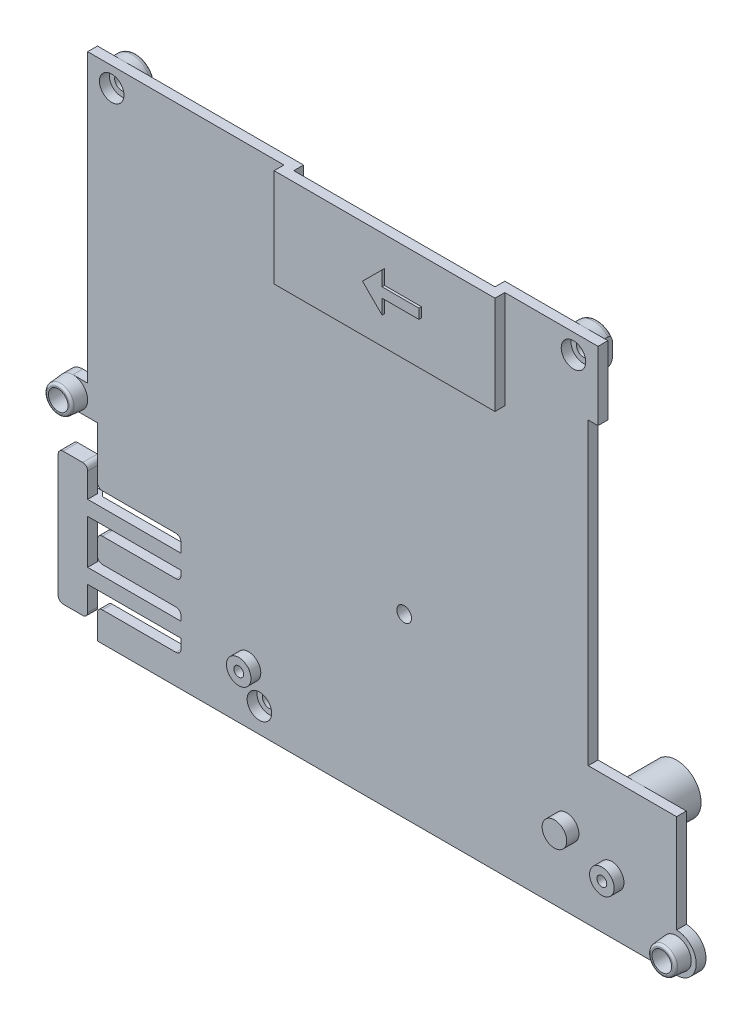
SolidWorks part; units mm, degrees
ref_plane "Face" through (0, 0, 0) normal (0, 0, 1) x (1, 0, 0)
ref_plane "Dessus" through (0, 0, 0) normal (0, 1, 0) x (1, 0, 0)
ref_plane "Droite" through (0, 0, 0) normal (1, 0, 0) x (0, 0, -1)
sketch "Esquisse1" plane through (0, 0, 0) normal (0, 0, 1) x (1, 0, 0)
  line L0 (0, -64.5) -> (2, -64.5)
  line L1 (0, 0) -> (0, -58.5)
  line L2 (2, -103) -> (120, -103)
  line L3 (120, -95) -> (120, -75)
  line L4 (120, -75) -> (102, -75)
  line L5 (102, -75) -> (102, -14)
  line L6 (102, -14) -> (104, -14)
  line L7 (104, -14) -> (104, 0)
  line L8 (104, 0) -> (0, 0)
  line L9 (2, -64.5) -> (2, -103)
  line L10 (0, -64.5) -> (-3, -64.5)
  line L11 (-3, -58.5) -> (0, -58.5)
  arc A0 (-3, -58.5) -> (-3, -64.5) centre (-3, -61.5) ccw
  arc A1 (120, -103) -> (120, -95) centre (120, -99) ccw
  dimension "D10" = 6
  dimension "D11" = 8
  dimension "D1" = 120
  dimension "D2" = 104
  dimension "D3" = 103
  dimension "D4" = 14
  dimension "D5" = 28
  dimension "D6" = 2
  dimension "D7" = 38.5
  dimension "D8" = 2
  dimension "D9" = 3
extrude "Extrusion1" add sketch "Esquisse1" along normal blind 2
sketch "Esquisse2" plane through (0, 0, 2) normal (0, 0, 1) x (1, 0, 0)
  line L0 (40, 0) -> (40, -20)
  line L1 (40, -20) -> (85, -20)
  line L2 (85, -20) -> (85, 0)
  line L3 (85, 0) -> (40, 0)
  line L4 (104, -14) -> (104, 0) construction
  line L5 (104, 0) -> (0, 0) construction
  dimension "D1" = 45
  dimension "D2" = 20
  dimension "D3" = 19
extrude "Extrusion2" add sketch "Esquisse2" along normal blind 2
sketch "Esquisse3" plane through (0, 0, 0) normal (0, 0, -1) x (-1, 0, 0)
  line L0 (-83, 0) -> (-83, -18)
  line L1 (-83, -18) -> (-42, -18)
  line L2 (-42, -18) -> (-42, 0)
  line L3 (-42, 0) -> (-83, 0)
  line L4 (-104, 0) -> (0, 0) construction
  line L5 (-40, -20) -> (-85, -20) construction
  line L6 (-40, 0) -> (-40, -20) construction
  line L7 (-85, -20) -> (-85, 0) construction
  dimension "D1" = 2
  dimension "D2" = 2
  dimension "D3" = 2
extrude "Enlèv. mat.-Extru.4" cut sketch "Esquisse3" against normal blind 2
sketch "Esquisse4" plane through (0, 0, 0) normal (0, 0, -1) x (-1, 0, 0)
  line L0 (-2, -103) -> (-120, -103) construction
  line L4 (-10, -68) -> (-12, -68)
  line L5 (-10, -50) -> (-10, -68)
  line L6 (-12, -68) -> (-12, -50)
  line L7 (-32, -19.6026) -> (-32, -21.7157)
  line L8 (0, 0) -> (0, -58.5) construction
  arc A2 (-10, -50) -> (-32, -19.6026) centre (-42, -50) ccw
  arc A3 (-12, -50) -> (-32, -21.7157) centre (-42, -50) ccw
  dimension "D1" = 30
  dimension "D2" = 32
  dimension "D3" = 42
  dimension "D4" = 53
  dimension "D5" = 18
  dimension "D6" = 10
extrude "Extrusion3" add sketch "Esquisse4" along normal blind 9.5
sketch "Esquisse5" plane through (0, 0, 0) normal (0, 0, -1) x (-1, 0, 0)
  line L6 (-85, -12.7047) -> (-85, -20)
  line L7 (-85, -12.7047) -> (-83, -13.02)
  line L8 (-83, -18) -> (-83, -13.02)
  line L9 (-42, -18) -> (-83, -18)
  line L10 (-85, -20) -> (-42, -20)
  line L11 (-32, -19.6026) -> (-32, -21.7157)
  line L12 (-32, -19.6026) -> (-32, -21.7157) construction
  line L13 (-83, 0) -> (-83, -18) construction
  line L14 (-85, -20) -> (-85, 0) construction
  arc A2 (-32, -19.6026) -> (-42, -18) centre (-42, -50) ccw
  arc A3 (-32, -21.7157) -> (-42, -20) centre (-42, -50) ccw
  arc A4 (-10, -50) -> (-32, -19.6026) centre (-42, -50) ccw construction
  arc A5 (-12, -50) -> (-32, -21.7157) centre (-42, -50) ccw construction
  dimension "D1" = 4.98
  dimension "D2" = 7.2953
extrude "Extrusion4" add sketch "Esquisse5" along normal blind 7
sketch "Esquisse6" plane through (0, 0, 2) normal (0, 0, 1) x (1, 0, 0)
  line L0 (-5.2627, -4) -> (14.8101, -4) construction
  line L1 (5, -14.2007) -> (5, 2.4267) construction
  line L2 (99, -4) -> (110.53, -4) construction
  line L3 (99, -4) -> (99, -14.1813) construction
  line L4 (89, -38) -> (73, -38) construction
  line L5 (73, -26) -> (78, -26) construction
  line L6 (87, -47) -> (92.5544, -47) construction
  line L7 (92.5544, -47) -> (87, -47) construction
  line L8 (87, -47) -> (87, -52.8482) construction
  line L9 (64.5, -67) -> (51.66, -67) construction
  line L10 (64.5, -67) -> (64.5, -58.9898) construction
  line L11 (35, -98) -> (45.5183, -98) construction
  line L12 (35, -98) -> (35, -106.1757) construction
  line L13 (32.78, -92) -> (106.78, -92) construction
  line L14 (71.55, -91) -> (87.55, -91) construction
  line L15 (51.61, -85) -> (51.61, -89.5483) construction
  line L16 (51.61, -89.5483) -> (51.61, -85) construction
  line L17 (51.61, -85) -> (59.749, -85) construction
  line L18 (97.61, -88) -> (97.61, -82.5079) construction
  line L19 (97.61, -82.5079) -> (97.61, -88) construction
  line L20 (97.61, -88) -> (102.441, -88) construction
  line L21 (110, -80) -> (110, -86.8519) construction
  line L22 (110, -80) -> (124.3112, -80) construction
  line L23 (120, -99) -> (106.78, -99) construction
  line L24 (120, -99) -> (120, -106.1757) construction
  line L25 (40, 0) -> (0, 0) construction
  line L26 (0, 0) -> (0, -58.5) construction
  line L27 (104, -14) -> (104, 0) construction
  line L28 (2, -103) -> (120, -103) construction
  line L29 (120, -95) -> (120, -75) construction
  line L30 (120, -75) -> (102, -75) construction
  line L31 (120, -95) -> (120, -75) construction
  line L32 (102, -75) -> (102, -14) construction
  point P27 (120, -85)
  dimension "D1" = 4
  dimension "D2" = 5
  dimension "D3" = 5
  dimension "D4" = 4
  dimension "D5" = 85
  dimension "D6" = 5
  dimension "D7" = 11
  dimension "D8" = 7
  dimension "D9" = 16.61
  dimension "D10" = 46
  dimension "D11" = 10
  dimension "D12" = 5
  dimension "D13" = 3
  dimension "D14" = 12
  dimension "D15" = 36
  dimension "D16" = 37.5
  dimension "D17" = 15
  dimension "D18" = 20
  dimension "D19" = 9
  dimension "D20" = 12
sketch "Esquisse7" plane through (0, 0, 4) normal (0, 0, 1) x (1, 0, 0)
  line L7 (62.5, -14) -> (58.5, -10)
  line L8 (58.5, -10) -> (62.5, -6)
  line L9 (62.5, -6) -> (62.5, -9)
  line L10 (62.5, -9) -> (70, -9)
  line L11 (70, -9) -> (70, -11)
  line L12 (70, -11) -> (62.5, -11)
  line L13 (62.5, -11) -> (62.5, -14)
  line L14 (85, -20) -> (85, 0) construction
  line L15 (85, 0) -> (40, 0) construction
  dimension "D1" = 7.5
  dimension "D2" = 2
  dimension "D3" = 90
  dimension "D4" = 3
  dimension "D5" = 3
  dimension "D6" = 15
  dimension "D7" = 9
  dimension "D8" = 1
extrude "Extrusion5" add sketch "Esquisse7" along normal blind 0.5
sketch "Esquisse8" plane through (0, 0, 0) normal (0, 0, -1) x (-1, 0, 0)
  line L0 (-2, -103) -> (-120, -103) construction
  line L1 (-75, -45) -> (-48, -45)
  line L2 (-75, -45) -> (-75, -47)
  line L3 (-75, -47) -> (-48, -47)
  line L4 (-48, -45) -> (-48, -47)
  line L5 (-102, -75) -> (-102, -14) construction
  dimension "D1" = 27
  dimension "D2" = 2
  dimension "D3" = 56
  dimension "D4" = 27
extrude "Extrusion6" add sketch "Esquisse8" along normal blind 7.5
sketch "Esquisse9" plane through (0, 0, 0) normal (0, 0, -1) x (-1, 0, 0)
  line L0 (0, 0) -> (0, -58.5) construction
  line L1 (-48, -66) -> (-17, -66)
  line L2 (-48, -66) -> (-48, -68)
  line L3 (-48, -68) -> (-17, -68)
  line L4 (-17, -66) -> (-17, -68)
  line L5 (-48, -71) -> (-17, -71)
  line L6 (-48, -71) -> (-48, -73)
  line L7 (-48, -73) -> (-17, -73)
  line L8 (-17, -71) -> (-17, -73)
  line L9 (-2, -103) -> (-120, -103) construction
  dimension "D1" = 17
  dimension "D2" = 31
  dimension "D3" = 2
  dimension "D4" = 2
  dimension "D5" = 3
  dimension "D6" = 30
extrude "Extrusion7" add sketch "Esquisse9" along normal blind 4
sketch "Esquisse10" plane through (0, 0, 0) normal (0, 0, -1) x (-1, 0, 0)
  line L1 (-48, -71) -> (-46, -71)
  line L2 (-48, -71) -> (-48, -98)
  line L3 (-48, -98) -> (-46, -98)
  line L4 (-46, -71) -> (-46, -98)
  dimension "D1" = 2
  dimension "D2" = 27
extrude "Extrusion8" add sketch "Esquisse10" along normal blind 6 draft 5
sketch "Esquisse11" plane through (0, 0, 0) normal (0, 0, -1) x (-1, 0, 0)
  line L0 (5.2627, -4) -> (-14.8101, -4) construction
  line L1 (-5, -14.2007) -> (-5, 2.4267) construction
  circle A0 centre (-5, -4) radius 4
  circle A1 centre (-99, -4) radius 4
  circle A2 centre (-35, -98) radius 4
  dimension "D1" = 8
  dimension "D2" = 8
  dimension "D3" = 8
extrude "Extrusion9" add sketch "Esquisse11" along normal blind 3
fillet "Congé1" radius 1 3 edges at (1, -4, -3) (31, -98, -3) (95, -4, -3)
sketch "Esquisse12" plane through (0, 0, 0) normal (0, 0, -1) x (-1, 0, 0)
  circle A0 centre (-64.5, -67) radius 4
  dimension "D1" = 8
extrude "Extrusion10" add sketch "Esquisse12" along normal blind 7
sketch "Esquisse13" plane through (0, 0, 0) normal (0, 0, -1) x (-1, 0, 0)
  circle A0 centre (-110, -80) radius 5
  dimension "D1" = 10
extrude "Extrusion11" add sketch "Esquisse13" along normal blind 8
sketch "Esquisse14" plane through (0, 0, -8) normal (0, 0, -1) x (-1, 0, 0)
  circle A0 centre (-110, -80) radius 3
  circle A1 centre (-110, -80) radius 5 construction
  dimension "D1" = 6
extrude "Enlèv. mat.-Extru.5" cut sketch "Esquisse14" against normal blind 5
sketch "Esquisse15" plane through (0, 0, 0) normal (0, 0, -1) x (-1, 0, 0)
  circle A0 centre (-97.61, -88) radius 3
  dimension "D1" = 6
extrude "Extrusion12" add sketch "Esquisse15" along normal blind 6.3
sketch "Esquisse17" plane through (0, 0, 0) normal (0, 0, -1) x (-1, 0, 0)
  line L0 (-42, 0) -> (-5, 0) construction
  line L1 (-104, 0) -> (-102, 0)
  line L2 (-104, 0) -> (-104, -8)
  line L3 (-104, -8) -> (-102, -8)
  line L4 (-102, 0) -> (-102, -8)
  line L5 (-104, -14) -> (-104, 0) construction
  line L6 (0, 0) -> (0, -58.5) construction
  line L8 (-2, 0) -> (0, 0)
  line L9 (-2, 0) -> (-2, -8)
  line L10 (-2, -8) -> (0, -8)
  line L11 (0, 0) -> (0, -8)
  line L12 (-2, -103) -> (-120, -103) construction
  line L13 (-39, -103) -> (-31, -103)
  line L14 (-39, -103) -> (-39, -101)
  line L15 (-39, -101) -> (-31, -101)
  line L16 (-31, -103) -> (-31, -101)
  circle A2 centre (-99, -4) radius 4 construction
  circle A3 centre (-5, -4) radius 4 construction
  circle A4 centre (-35, -98) radius 4 construction
  dimension "D1" = 2
  dimension "D2" = 2
  dimension "D3" = 2
extrude "Enlèv. mat.-Extru.7" cut sketch "Esquisse17" along normal up to next
sketch "Esquisse18" plane through (0, 0, 2) normal (0, 0, 1) x (1, 0, 0)
  circle A0 centre (120, -99) radius 3
  circle A1 centre (-3, -61.5) radius 3
  arc A2 (-3, -58.5) -> (-3, -64.5) centre (-3, -61.5) ccw construction
  dimension "D1" = 6
  dimension "D2" = 6
extrude "Extrusion13" add sketch "Esquisse18" along normal blind 3 draft 5
sketch "Esquisse19" plane through (0, 0, 5) normal (0, 0, 1) x (1, 0, 0)
  circle A0 centre (-3, -61.5) radius 2
  circle A1 centre (120, -99) radius 2
  circle A4 centre (-3, -61.5) radius 2.7375 construction
  dimension "D1" = 4
  dimension "D2" = 4
extrude "Enlèv. mat.-Extru.8" cut sketch "Esquisse19" against normal blind 3
fillet "Congé2" radius 0.5 2 edges at (122.7375, -99, 5) (-0.2625, -61.5, 5)
sketch "Esquisse20" plane through (0, 0, 2) normal (0, 0, 1) x (1, 0, 0)
  circle A0 centre (97.61, -88) radius 2.5
  dimension "D1" = 5
extrude "Extrusion14" add sketch "Esquisse20" along normal blind 2.5
sketch "Esquisse21" plane through (0, 0, 2) normal (0, 0, 1) x (1, 0, 0)
  circle A0 centre (32.78, -92) radius 2.5
  circle A1 centre (106.78, -92) radius 2.5
  dimension "D1" = 5
  dimension "D2" = 5
extrude "Extrusion15" add sketch "Esquisse21" along normal blind 2
sketch "Esquisse16" plane through (0, 0, 0) normal (0, 0, -1) x (-1, 0, 0)
  circle A0 centre (-106.78, -92) radius 1
  circle A1 centre (-32.78, -92) radius 1
  dimension "D1" = 2
  dimension "D2" = 2
extrude "Enlèv. mat.-Extru.6" cut sketch "Esquisse16" against normal through all
hole_wizard "Chambrage pour vis à tête hexagonale M2.51" positions "Esquisse3D1" profile "Esquisse22" counterbore size "M2.5" standard "ISO"
sketch3d "Esquisse3D1"
  line L0 (-5.2627, -4, 2) -> (14.8101, -4, 2) construction
  point P0 (4.9018, -4, 2)
  point P3 (35, -98, 2)
  point P5 (99, -4, 2)
sketch "Esquisse22" plane through (4.9018, -4, 2) normal (1, 0, 0) x (0, -1, 0)
  line L0 (0, 0) -> (0, 29.8412)
  line L1 (0, 29.8412) -> (1.4, 29)
  line L2 (1.4, 29) -> (1.4, 2)
  line L3 (1.4, 2) -> (2.5, 2)
  line L4 (2.5, 2) -> (2.5, 0)
  line L5 (2.5, 0) -> (0, 0)
  line L10 (0, 29.8412) -> (-1.4, 29) construction
  line L11 (0, -6.35) -> (0, 107.95) construction
  dimension "Diamètre du perçage" = 2.8
  dimension "Profondeur du perçage" = 29
  dimension "Diamètre du chambrage" = 5
  dimension "Profondeur du chambrage" = 2
  dimension "Angle de pointe" = 118
hole_wizard "Dégagement M2.51" positions "Esquisse24" profile "Esquisse23" hole size "M2.5" standard "Ansi Métrique"
sketch "Esquisse24" plane through (0, 0, 2) normal (0, 0, 1) x (1, 0, 0)
  circle A0 centre (-3, -61.5) radius 2.2794 construction
  circle A1 centre (120, -99) radius 2 construction
  point P0 (-3, -61.5)
  point P3 (120, -99)
sketch "Esquisse23" plane through (-3, -61.5, 2) normal (1, 0, 0) x (0, -1, 0)
  line L0 (0, 0) -> (0, 11.5)
  line L1 (0, 11.5) -> (1.4, 11.5)
  line L2 (1.4, 11.5) -> (1.4, 0)
  line L5 (1.4, 0) -> (0, 0)
  line L11 (0, -6.35) -> (0, 107.95) construction
  dimension "Diamètre du perçage jusqu'au prochain" = 2.8
  dimension "Profondeur du perçage jusqu'au prochain" = 11.5
sketch "Esquisse25" plane through (0, 0, 2) normal (0, 0, 1) x (1, 0, 0)
  line L0 (2, -103) -> (120, -103) construction
  line L1 (2, -76) -> (18, -76)
  line L2 (2, -76) -> (2, -79)
  line L3 (2, -79) -> (19, -79)
  line L4 (19, -77) -> (19, -79)
  line L5 (2, -82) -> (19, -82)
  line L6 (2, -82) -> (2, -84)
  line L7 (2, -84) -> (18, -84)
  line L8 (19, -82) -> (19, -83)
  line L9 (2, -89) -> (18, -89)
  line L10 (2, -89) -> (2, -91)
  line L11 (2, -91) -> (19, -91)
  line L12 (19, -90) -> (19, -91)
  line L13 (2, -94) -> (19, -94)
  line L14 (2, -94) -> (2, -97)
  line L15 (2, -97) -> (18, -97)
  line L16 (19, -94) -> (19, -96)
  line L17 (2, -64.5) -> (2, -103) construction
  arc A0 (18, -76) -> (19, -77) centre (18, -77) cw
  arc A1 (18, -84) -> (19, -83) centre (18, -83) ccw
  arc A2 (18, -89) -> (19, -90) centre (18, -90) cw
  arc A3 (18, -97) -> (19, -96) centre (18, -96) ccw
  point P30 (19, -97)
  dimension "D10" = 1
  dimension "D1" = 6
  dimension "D2" = 3
  dimension "D3" = 3
  dimension "D4" = 2
  dimension "D5" = 5
  dimension "D6" = 2
  dimension "D7" = 3
  dimension "D8" = 3
  dimension "D9" = 17
extrude "Enlèv. mat.-Extru.9" cut sketch "Esquisse25" against normal through all
fillet "Congé3" radius 1 4 edges at (2, -76, 1) (2, -97, 1) (2, -89, 1) (2, -84, 1)
sketch "Esquisse26" plane through (0, 0, 2) normal (0, 0, 1) x (1, 0, 0)
  line L0 (2, -79) -> (0, -79)
  line L1 (0, -79) -> (0, -73)
  line L2 (0, -73) -> (-6, -73)
  line L3 (-6, -73) -> (-6, -100)
  line L4 (-6, -100) -> (0, -100)
  line L5 (0, -100) -> (0, -94)
  line L6 (0, -94) -> (2, -94)
  line L7 (2, -94) -> (2, -91)
  line L8 (2, -91) -> (0, -91)
  line L9 (0, -91) -> (0, -82)
  line L10 (0, -82) -> (2, -82)
  line L11 (2, -82) -> (2, -79)
  line L12 (2, -91) -> (2, -94) construction
  line L13 (2, -91) -> (19, -91) construction
  line L14 (19, -82) -> (2, -82) construction
  line L15 (2, -79) -> (19, -79) construction
  line L16 (19, -94) -> (2, -94) construction
  line L17 (2, -85) -> (2, -88) construction
  line L18 (2, -103) -> (120, -103) construction
  point P24 (2, -86.5)
  dimension "D1" = 2
  dimension "D2" = 3
  dimension "D3" = 6
  dimension "D4" = 27
extrude "Extrusion16" add sketch "Esquisse26" against normal blind 2
sketch "Esquisse27" plane through (0, -100, 0) normal (0, -1, 0) x (1, 0, 0)
  line L0 (-6, 0) -> (-6, -1)
  line L1 (-6, -1) -> (-1, -1)
  line L2 (-1, -1) -> (0, 0)
  line L3 (0, 0) -> (-6, 0)
  dimension "D1" = 1
  dimension "D2" = 135
extrude "Extrusion17" add sketch "Esquisse27" against normal up to surface (27 mm away)
sketch "Esquisse28" plane through (0, -94, 0) normal (0, -1, 0) x (1, 0, 0)
  line L0 (0, 0) -> (-1, -1)
  line L1 (-1, -1) -> (0, -1)
  line L2 (0, -1) -> (1, 0)
  line L3 (19, 0) -> (0, 0) construction
  line L4 (1, 0) -> (0, 0)
extrude "Extrusion18" add sketch "Esquisse28" against normal up to surface (3 mm away)
sketch "Esquisse29" plane through (0, -79, 0) normal (0, 1, 0) x (-1, 0, 0)
  line L0 (1, -1) -> (0, 0)
  line L1 (0, 0) -> (-1, 0)
  line L2 (-1, 0) -> (0, -1)
  line L3 (0, -1) -> (1, -1)
extrude "Extrusion19" add sketch "Esquisse29" against normal up to surface (3 mm away)
hole_wizard "Dégagement M2.52" positions "Esquisse3D2" profile "Esquisse30" hole size "M2.5" standard "Ansi Métrique"
sketch3d "Esquisse3D2"
  point P0 (64.5, -67, 2)
sketch "Esquisse30" plane through (64.5, -67, 2) normal (1, 0, 0) x (0, -1, 0)
  line L0 (0, 0) -> (0, 11.5)
  line L1 (0, 11.5) -> (1.5, 11.5)
  line L2 (1.5, 11.5) -> (1.5, 0)
  line L5 (1.5, 0) -> (0, 0)
  line L11 (0, -6.35) -> (0, 107.95) construction
  dimension "Diamètre du perçage jusqu'au prochain" = 3
  dimension "Profondeur du perçage jusqu'au prochain" = 11.5
sketch "Esquisse31" plane through (0, 0, -6.3) normal (0, 0, -1) x (-1, 0, 0)
  circle A0 centre (-97.61, -88) radius 1
  circle A1 centre (-97.61, -88) radius 3 construction
  dimension "D1" = 2
extrude "Enlèv. mat.-Extru.10" cut sketch "Esquisse31" against normal blind 8
fillet "Congé4" radius 1 4 edges at (0, -100, 1) (-6, -100, 0.5) (-6, -73, 0.5) (0, -73, 1)
